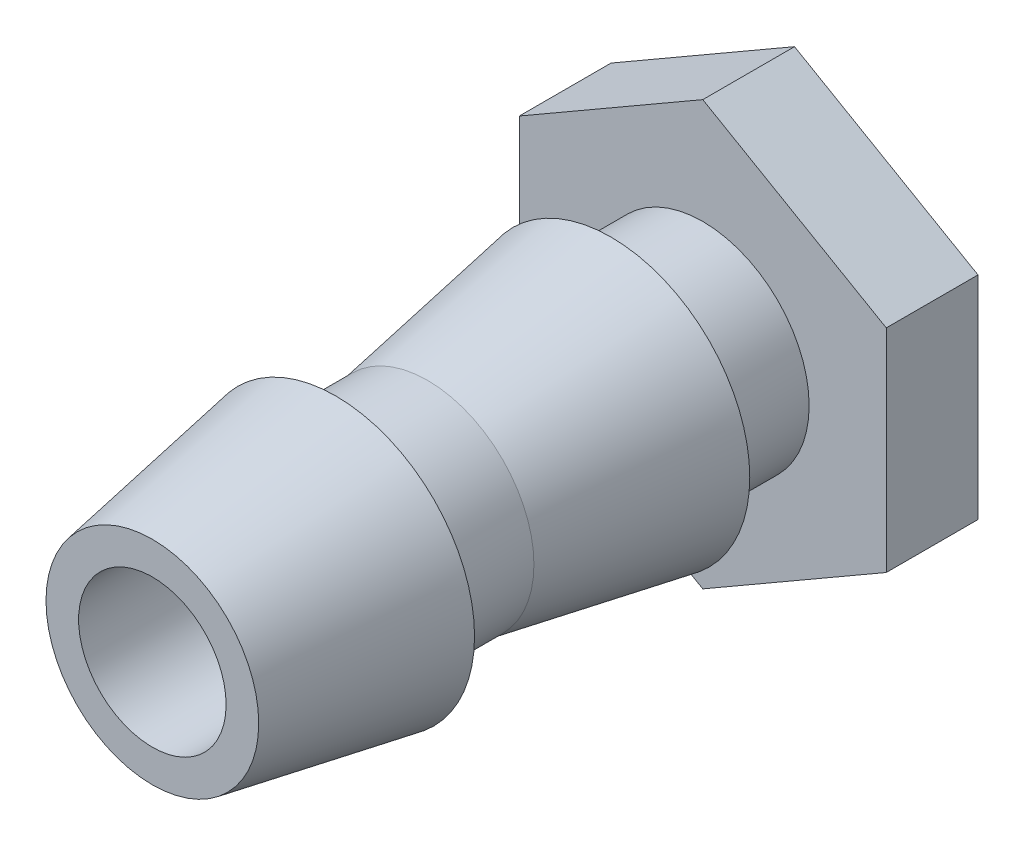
SolidWorks part; units mm, degrees
ref_plane "FRONT" through (0, 0, 0) normal (0, 0, 1) x (1, 0, 0)
ref_plane "TOP" through (0, 0, 0) normal (0, 1, 0) x (1, 0, 0)
ref_plane "SIDE" through (0, 0, 0) normal (1, 0, 0) x (0, 0, -1)
sketch "Sketch1" plane through (0, 0, 0) normal (0, 0, 1) x (1, 0, 0)
  line L1 (6.35, 3.6662) -> (0, 7.3323)
  line L2 (0, 7.3323) -> (-6.35, 3.6662)
  line L3 (-6.35, 3.6662) -> (-6.35, -3.6662)
  line L4 (-6.35, -3.6662) -> (0, -7.3323)
  line L5 (0, -7.3323) -> (6.35, -3.6662)
  line L6 (6.35, -3.6662) -> (6.35, 3.6662)
  circle A0 centre (0, 0) radius 6.35 construction
  dimension "D1" = 12.7
extrude "Base-Extrude" add sketch "Sketch1" along normal blind 3.175
sketch "Sketch2" plane through (0, 0, 3.175) normal (0, 0, 1) x (1, 0, 0)
  circle A0 centre (0, 0) radius 4.8006
  dimension "D1" = 9.6012
extrude "Boss-Extrude1" add sketch "Sketch2" along normal blind 19.05
hole_wizard "1/4-20 Tapped Hole1" positions "Sketch4" profile "Sketch3" tap size "1/4-20" standard "Ansi Inch"
sketch "Sketch4" plane through (0, 0, 22.225) normal (0, 0, 1) x (1, 0, 0)
  point P0 (0, 0)
sketch "Sketch3" plane through (0, 0, 22.225) normal (1, 0, 0) x (0, -1, 0)
  line L0 (0, 0) -> (0, 22.225)
  line L1 (0, 22.225) -> (2.5527, 22.225)
  line L2 (2.5527, 22.225) -> (2.5527, 0)
  line L5 (2.5527, 0) -> (0, 0)
  line L11 (0, -6.35) -> (0, 107.95) construction
  dimension "Thru Hole Dia." = 5.1054
  dimension "Thru Hole Depth" = 22.225
sketch "Sketch6" plane through (0, 0, 0) normal (1, 0, 0) x (0, 0, -1)
  line L0 (-22.225, 3.6809) -> (-15.875, 4.8006)
  line L3 (-15.875, 4.8006) -> (-15.875, 3.6809)
  line L4 (-15.875, 3.6809) -> (-12.7, 3.6809)
  line L5 (-12.7, 3.6809) -> (-6.35, 4.8006)
  line L6 (-6.35, 4.8006) -> (-6.35, 3.6809)
  line L7 (-6.35, 3.6809) -> (-3.175, 3.6809)
  line L8 (-3.175, 7.3323) -> (-3.175, 3.6662) construction
  line L9 (-3.175, 3.6809) -> (-3.175, 12.7)
  line L10 (-3.175, 12.7) -> (-22.225, 12.7)
  line L11 (-22.225, 12.7) -> (-22.225, 3.6809)
  line L12 (0, 0) -> (-3.81, 0) construction
  line L13 (-22.225, 0) -> (-3.175, 0) construction
  line L14 (-22.225, 4.8006) -> (-22.225, -4.8006) construction
  line L15 (-3.175, 4.8006) -> (-22.225, 4.8006) construction
  dimension "D1" = 3.175
  dimension "D2" = 3.175
  dimension "D3" = 6.35
  dimension "D5" = 12.7
  dimension "D6" = 80
revolve "Cut-Revolve1" cut sketch "Sketch6" angle 360 about L12
